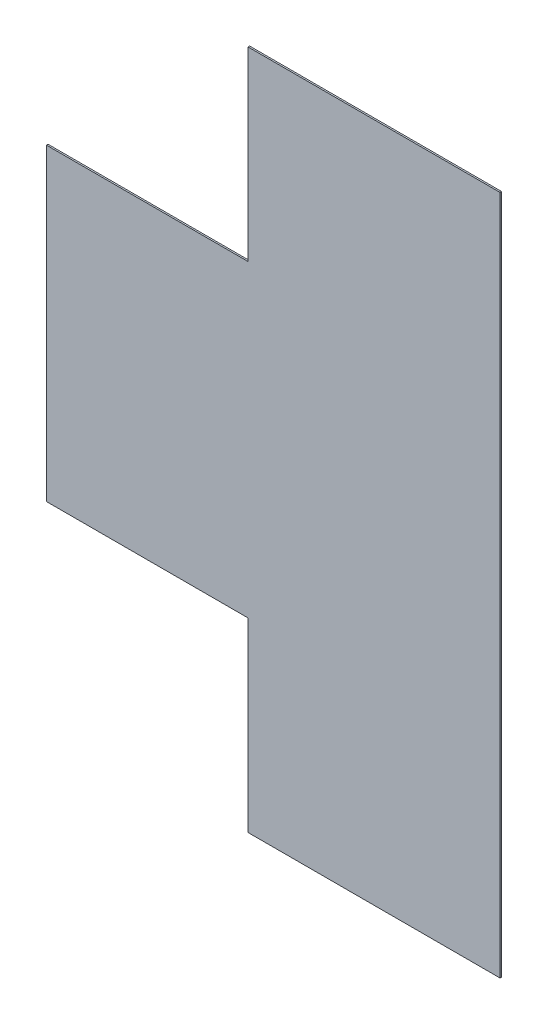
SolidWorks part; units mm, degrees
ref_plane "Front Plane" through (0, 0, 0) normal (0, 0, 1) x (1, 0, 0)
ref_plane "Top Plane" through (0, 0, 0) normal (0, 1, 0) x (1, 0, 0)
ref_plane "Right Plane" through (0, 0, 0) normal (1, 0, 0) x (0, 0, -1)
sketch "Sketch1" plane through (0, 0, 0) normal (0, 0, 1) x (1, 0, 0)
  line L0 (25.787, -495.096) -> (-177.413, -495.096) construction
  line L1 (279.787, -307.771) -> (25.787, -307.771)
  line L2 (279.787, -307.771) -> (279.787, -993.571)
  line L3 (279.787, -993.571) -> (25.787, -993.571)
  line L4 (25.787, -307.771) -> (25.787, -495.096)
  line L5 (-177.413, -806.246) -> (25.787, -806.246)
  line L6 (-177.413, -806.246) -> (-177.413, -495.096)
  line L7 (-177.413, -495.096) -> (25.787, -495.096)
  line L9 (25.787, -806.246) -> (25.787, -993.571)
extrude "Boss-Extrude1" add sketch "Sketch1" along normal blind 1.5875
